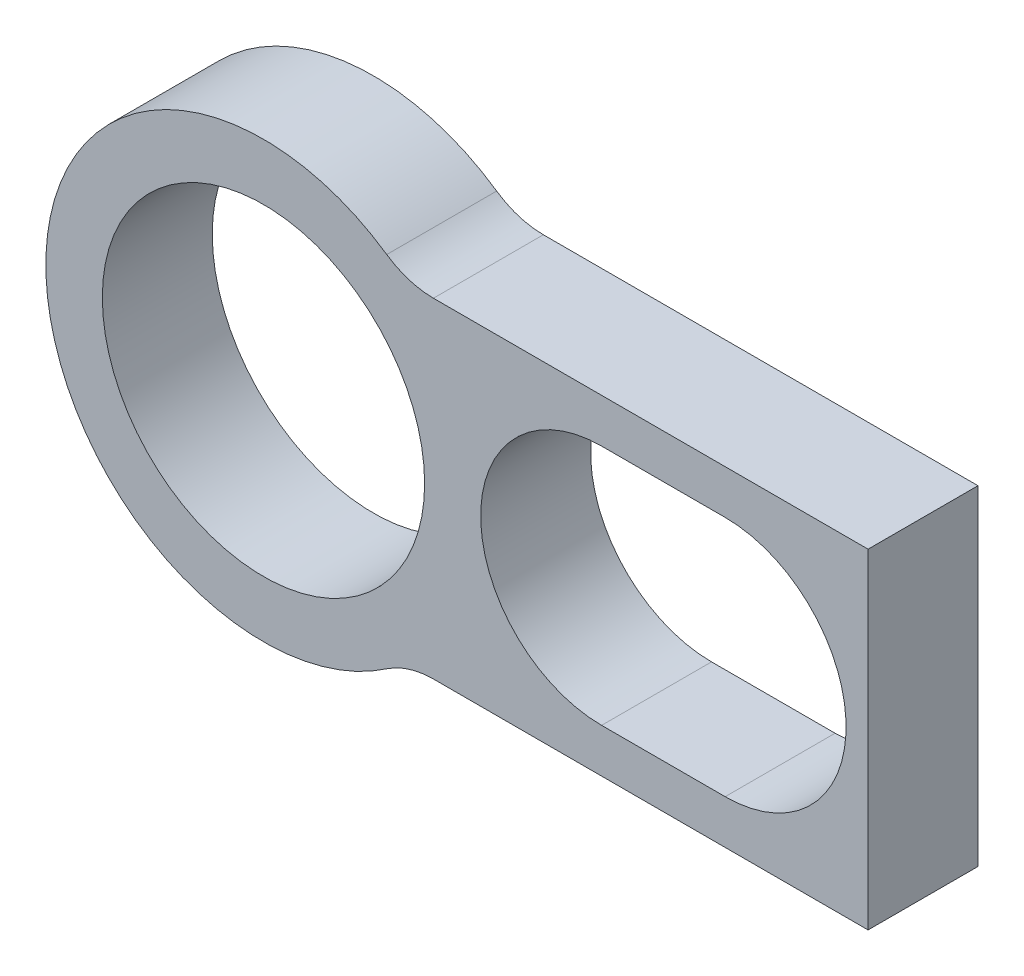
SolidWorks part; units mm, degrees
ref_plane "Front" through (0, 0, 0) normal (0, 0, 1) x (1, 0, 0)
ref_plane "Top" through (0, 0, 0) normal (0, 1, 0) x (1, 0, 0)
ref_plane "Right" through (0, 0, 0) normal (1, 0, 0) x (0, 0, -1)
sketch "Sketch1" plane through (0, 0, 0) normal (0, 0, 1) x (1, 0, 0)
  line L0 (0, 12.573) -> (34.925, 12.573)
  line L1 (34.925, 12.573) -> (34.925, -12.573)
  line L2 (34.925, -12.573) -> (0, -12.573)
  arc A0 (0, 12.573) -> (0, -12.573) centre (0, 0) ccw
  circle A1 centre (0, 0) radius 9.3726
  dimension "D2" = 18.7452
  dimension "D4" = 18.7452
  dimension "D1" = 12.573
  dimension "D3" = 34.925
  dimension "D5" = 34.925
extrude "Extrude1" add sketch "Sketch1" along normal mid plane 6.35
sketch "Sketch7" plane through (0, 0, -3.175) normal (0, 0, -1) x (-1, 0, 0)
  line L0 (18.2412, 0) -> (-53.3935, 0) construction
  line L1 (-34.925, 9.525) -> (-8.207, 9.525)
  line L2 (-34.925, -12.573) -> (-34.925, 12.573) construction
  line L3 (-34.925, -12.573) -> (-34.925, -9.525)
  line L4 (-34.925, 12.573) -> (0, 12.573) construction
  line L5 (0, 12.573) -> (-34.925, 12.573)
  line L6 (-34.925, 12.573) -> (-34.925, 9.525)
  line L7 (0, -12.573) -> (-34.925, -12.573)
  line L8 (-34.925, -9.525) -> (-8.207, -9.525)
  arc A0 (0, -12.573) -> (-8.207, -9.525) centre (0, 0) cw
  arc A2 (0, 12.573) -> (-8.207, 9.525) centre (0, 0) ccw
  arc A3 (0, -12.573) -> (0, 12.573) centre (0, 0) ccw construction
  dimension "D1" = 19.05
extrude "Cut-Extrude2" cut sketch "Sketch7" against normal through all
sketch "Sketch6" plane through (0, 0, -3.175) normal (0, 0, -1) x (-1, 0, 0)
  line L0 (-26.67, 6.985) -> (-19.5326, 6.985)
  line L1 (-26.67, -6.985) -> (-19.5326, -6.985)
  line L2 (0, 0) -> (-14.2875, 0) construction
  line L3 (-34.925, -9.525) -> (-34.925, 9.525) construction
  line L4 (-18.415, 0) -> (-34.925, 0) construction
  line L5 (-34.925, 9.525) -> (-8.207, 9.525) construction
  line L7 (-9.3726, -18.9623) -> (-9.3726, 23.2925) construction
  line L8 (-34.925, -9.525) -> (-34.925, 9.525) construction
  arc A0 (-19.5326, -6.985) -> (-19.5326, 6.985) centre (-19.5326, 0) ccw
  arc A1 (-26.67, 6.985) -> (-26.67, -6.985) centre (-26.67, 0) ccw
  circle A2 centre (0, 0) radius 9.3726 construction
  dimension "D1" = 2.54
  dimension "D3" = 1.27
  dimension "D2" = 3.175
extrude "Cut-Extrude1" cut sketch "Sketch6" against normal through all
fillet "Fillet3" radius 4.7625 1 edges at (8.207, -9.525, 0)
fillet "Fillet4" radius 4.7625 1 edges at (8.207, 9.525, 0)
sketch "Sketch8" plane through (0, 0, 3.175) normal (0, 0, 1) x (1, 0, 0)
  arc A3 (0, 9.3726) -> (0, -9.3726) centre (0, 0) ccw construction
  arc A4 (0, -9.3726) -> (0, 9.3726) centre (0, 0) ccw construction
  arc A5 (0, 9.3091) -> (0, -9.3091) centre (0, 0) ccw
  arc A6 (0, -9.3091) -> (0, 9.3091) centre (0, 0) ccw
  arc A7 (0, 9.3091) -> (0, -9.3091) centre (0, 0) ccw
  arc A8 (0, -9.3091) -> (0, 9.3091) centre (0, 0) ccw
  arc A9 (0, 9.3726) -> (0, -9.3726) centre (0, 0) ccw
  arc A10 (0, -9.3726) -> (0, 9.3726) centre (0, 0) ccw
  dimension "D1" = 0.0635
extrude "Extrude3" add sketch "Sketch8" against normal up to surface (6.35 mm away)
